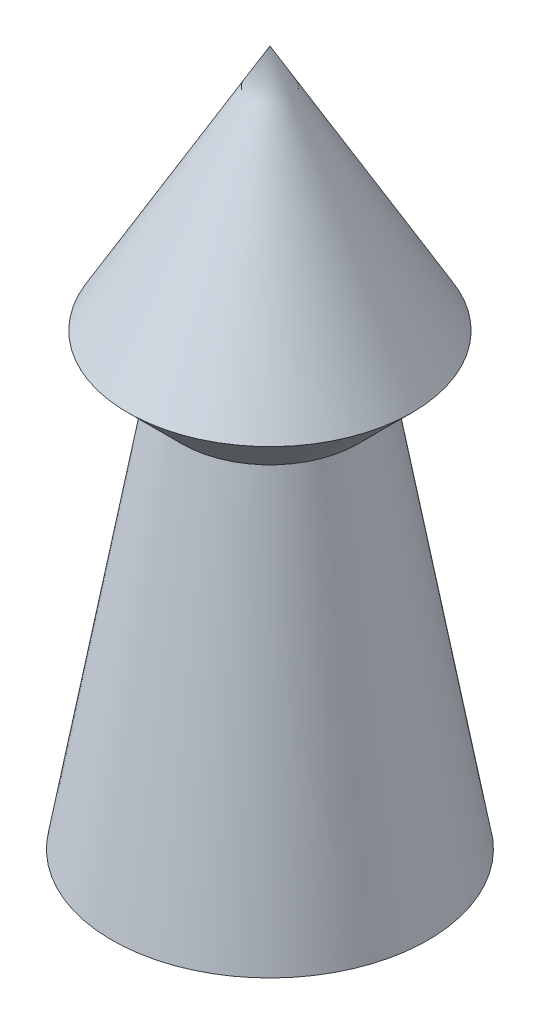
SolidWorks part; units mm, degrees
ref_plane "Plan de face" through (0, 0, 0) normal (0, 0, 1) x (1, 0, 0)
ref_plane "Plan de dessus" through (0, 0, 0) normal (0, 1, 0) x (1, 0, 0)
ref_plane "Plan de droite" through (0, 0, 0) normal (1, 0, 0) x (0, 0, -1)
sketch "Esquisse1" plane through (0, 0, 0) normal (0, 0, 1) x (1, 0, 0)
  line L0 (0, 0) -> (10, 0)
  line L1 (10, 0) -> (5.5918, 25)
  line L2 (5.5918, 25) -> (9.0012, 28.4094)
  line L3 (9.0012, 28.4094) -> (0, 44)
  line L4 (0, 44) -> (0, 0)
  dimension "D1" = 10
  dimension "D2" = 44
  dimension "D3" = 45
  dimension "D4" = 80
  dimension "D5" = 25
  dimension "D6" = 30
revolve "Révolution1" add sketch "Esquisse1" angle 360 about L4
